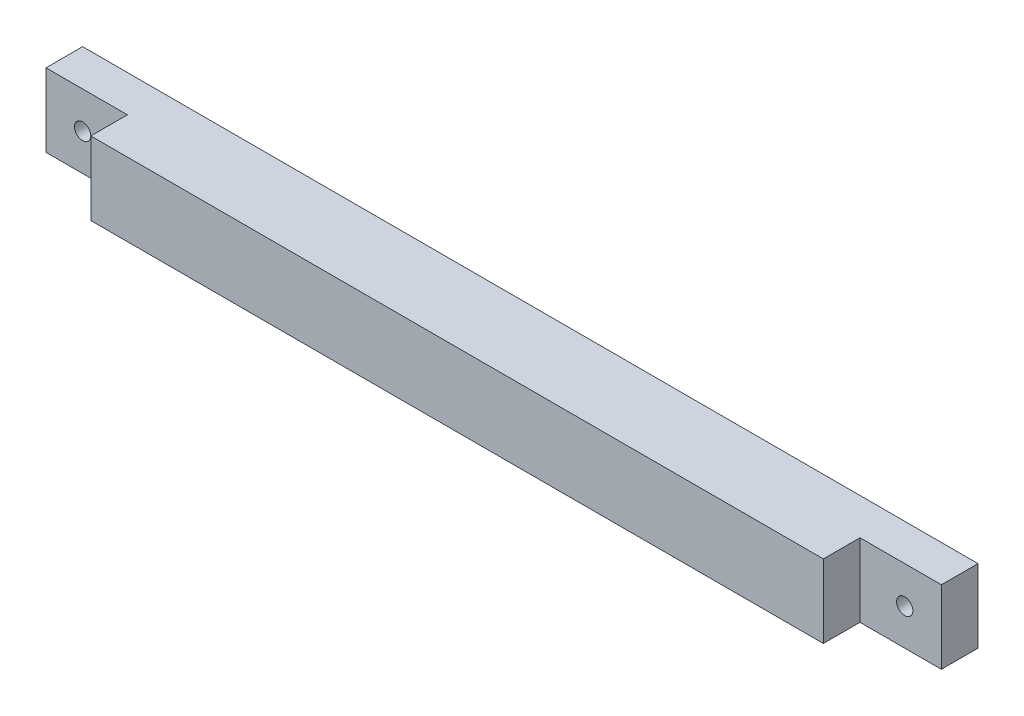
SolidWorks part; units mm, degrees
ref_plane "Face" through (0, 0, 0) normal (0, 0, 1) x (1, 0, 0)
ref_plane "Dessus" through (0, 0, 0) normal (0, 1, 0) x (1, 0, 0)
ref_plane "Droite" through (0, 0, 0) normal (1, 0, 0) x (0, 0, -1)
sketch "Esquisse1" plane through (0, 0, 0) normal (0, 0, 1) x (1, 0, 0)
  line L1 (-67.2717, -109.6176) -> (42.7283, -109.6176)
  line L2 (-67.2717, -109.6176) -> (-67.2717, -100.6176)
  line L3 (-67.2717, -100.6176) -> (42.7283, -100.6176)
  line L4 (42.7283, -109.6176) -> (42.7283, -100.6176)
  dimension "D1" = 110
  dimension "D2" = 9
extrude "Extrusion1" add sketch "Esquisse1" along normal blind 9
sketch "Esquisse2" plane through (0, 0, 9) normal (0, 0, 1) x (1, 0, 0)
  line L0 (42.7283, -100.6176) -> (-67.2717, -100.6176) construction
  line L1 (-67.2717, -109.6176) -> (-57.2717, -109.6176)
  line L2 (-67.2717, -109.6176) -> (-67.2717, -100.6176)
  line L3 (-67.2717, -100.6176) -> (-57.2717, -100.6176)
  line L4 (-57.2717, -109.6176) -> (-57.2717, -100.6176)
  line L6 (42.7283, -109.6176) -> (32.7283, -109.6176)
  line L7 (42.7283, -109.6176) -> (42.7283, -100.6176)
  line L8 (42.7283, -100.6176) -> (32.7283, -100.6176)
  line L9 (32.7283, -109.6176) -> (32.7283, -100.6176)
  dimension "D1" = 10
  dimension "D2" = 10
extrude "Enlèv. mat.-Extru.1" cut sketch "Esquisse2" against normal blind 4.5
sketch "Esquisse4" plane through (0, 0, 4.5) normal (0, 0, 1) x (1, 0, 0)
  line L0 (42.7283, -109.6176) -> (42.7283, -100.6176) construction
  line L1 (32.7283, -109.6176) -> (42.7283, -109.6176) construction
  circle A0 centre (38.2284, -105.1454) radius 1
  point P2 (42.7283, -105.1176)
  point P5 (37.7283, -109.6176)
  dimension "D3" = 2
  dimension "D1" = 4.5
  dimension "D2" = 4.5
extrude "Enlèv. mat.-Extru.2" cut sketch "Esquisse4" against normal blind 4.5
sketch "Esquisse5" plane through (0, 0, 4.5) normal (0, 0, 1) x (1, 0, 0)
  line L0 (-67.2717, -109.6176) -> (-57.2717, -109.6176) construction
  line L1 (-67.2717, -100.6176) -> (-67.2717, -109.6176) construction
  circle A0 centre (-62.7717, -105.1176) radius 1
  dimension "D1" = 2
  dimension "D2" = 4.5
  dimension "D3" = 4.5
extrude "Enlèv. mat.-Extru.3" cut sketch "Esquisse5" against normal blind 4.5
